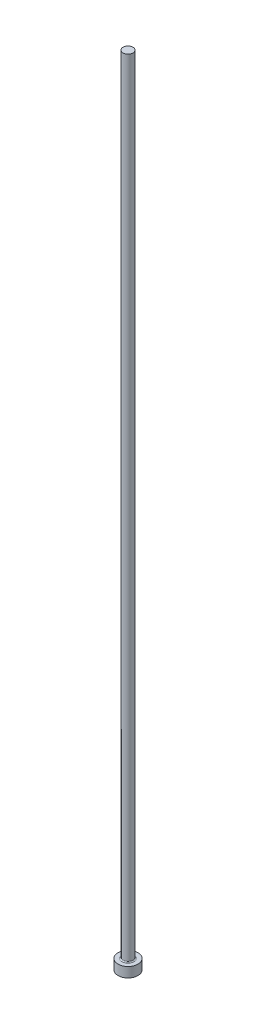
SolidWorks part; units mm, degrees
ref_plane "Plano frontal" through (0, 0, 0) normal (0, 0, 1) x (1, 0, 0)
ref_plane "Plano superior" through (0, 0, 0) normal (0, 1, 0) x (1, 0, 0)
ref_plane "Plano direito" through (0, 0, 0) normal (1, 0, 0) x (0, 0, -1)
sketch "Esboço1" plane through (0, 0, 0) normal (0, 0, 1) x (1, 0, 0)
  line L0 (0, 0) -> (2, 0)
  line L1 (2, 0) -> (2, 2)
  line L2 (2, 2) -> (1.2, 2)
  line L3 (1, 2.2) -> (1, 160)
  line L4 (1, 160) -> (0, 160)
  line L5 (0, 160) -> (0, 0) construction
  line L6 (0, 0) -> (0, 160)
  arc A0 (1.2, 2) -> (1, 2.2) centre (1.2, 2.2) cw
  dimension "D3" = 0.2
  dimension "D1" = 4
  dimension "D2" = 2
  dimension "D4" = 2
  dimension "D5" = 160
revolve "Revolução1" add sketch "Esboço1" angle 360 about L5
sketch "Esboço2"
  dimension "D1" = 1.075
  dimension "D2" = 0.35
  dimension "D3" = 0.225
  dimension "D4" = 0.15
wrap "Envolver1" sketch "Esboço2" wrap type deboss source sketch "Esboço2" thickness 0.1 parameters "D1"=0.1
